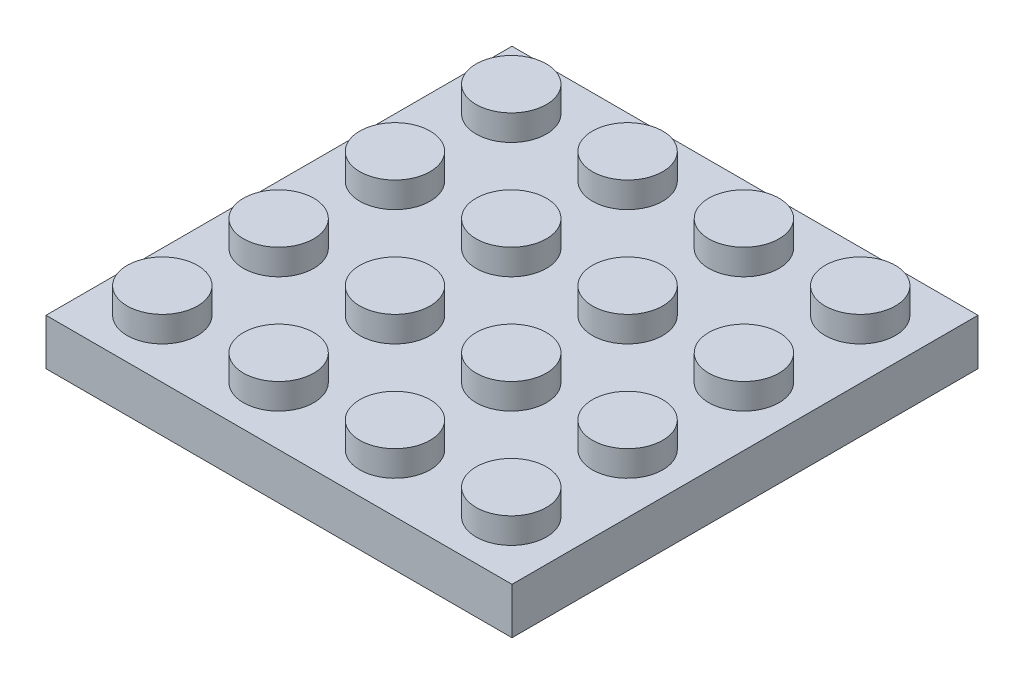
SolidWorks part; units mm, degrees
ref_plane "Front Plane" through (0, 0, 0) normal (0, 0, 1) x (1, 0, 0)
ref_plane "Top Plane" through (0, 0, 0) normal (0, 1, 0) x (1, 0, 0)
ref_plane "Right Plane" through (0, 0, 0) normal (1, 0, 0) x (0, 0, -1)
sketch "Sketch1" plane through (0, 0, 0) normal (0, 1, 0) x (1, 0, 0)
  line L0 (-15.9, 15.9) -> (15.9, -15.9) construction
  line L1 (-15.9, 15.9) -> (15.9, 15.9)
  line L2 (-15.9, 15.9) -> (-15.9, -15.9)
  line L3 (-15.9, -15.9) -> (15.9, -15.9)
  line L4 (15.9, 15.9) -> (15.9, -15.9)
  dimension "D1" = 31.8
  dimension "D2" = 31.8
extrude "Extrude1" add sketch "Sketch1" along normal blind 3.16
sketch "Sketch2" plane through (0, 3.16, 0) normal (0, 1, 0) x (1, 0, 0)
  line L0 (-15.9, -15.9) -> (15.9, -15.9) construction
  line L1 (-15.9, 15.9) -> (-15.9, -15.9) construction
  line L2 (-11.9313, -11.9313) -> (-3.9937, -11.9313) construction
  line L3 (-11.9313, -11.9313) -> (-11.9313, -3.9938) construction
  circle A0 centre (-11.9313, -11.9313) radius 2.4
  circle A4 centre (-3.9937, -11.9313) radius 2.4
  circle A5 centre (3.9437, -11.9313) radius 2.4
  circle A6 centre (11.8812, -11.9313) radius 2.4
  circle A7 centre (-11.9313, -3.9938) radius 2.4
  circle A8 centre (-3.9937, -3.9938) radius 2.4
  circle A14 centre (3.9438, -3.9938) radius 2.4
  circle A15 centre (11.8813, -3.9938) radius 2.4
  circle A16 centre (-11.9313, 3.9437) radius 2.4
  circle A17 centre (-3.9938, 3.9437) radius 2.4
  circle A18 centre (3.9437, 3.9437) radius 2.4
  circle A19 centre (11.8812, 3.9437) radius 2.4
  circle A20 centre (-11.9313, 11.8812) radius 2.4
  circle A21 centre (-3.9938, 11.8812) radius 2.4
  circle A22 centre (3.9437, 11.8812) radius 2.4
  circle A23 centre (11.8812, 11.8812) radius 2.4
  dimension "D3" = 4.8
  dimension "D1" = 3.9688
  dimension "D2" = 3.9688
  dimension "D4" = 7.9375
  dimension "D5" = 7.9375
  dimension "D6" = 90
extrude "Extrude2" add sketch "Sketch2" along normal blind 1.75
shell "Shell1" thickness 1.5875
sketch "Sketch3" plane through (0, 1.5725, 0) normal (0, -1, 0) x (1, 0, 0)
  line L0 (-15.9, 15.9) -> (15.9, 15.9) construction
  line L2 (-15.9, -15.9) -> (-15.9, 15.9) construction
  line L3 (-7.9625, 7.9625) -> (-0.025, 7.9625) construction
  line L4 (-7.9625, 7.9625) -> (-7.9625, 0.025) construction
  circle A0 centre (-7.9625, 7.9625) radius 3.175
  circle A1 centre (-7.9625, 7.9625) radius 2.3813
  circle A2 centre (-0.025, 7.9625) radius 2.3813
  circle A3 centre (-0.025, 7.9625) radius 3.175
  circle A4 centre (7.9125, 7.9625) radius 2.3813
  circle A5 centre (7.9125, 7.9625) radius 3.175
  circle A12 centre (-7.9625, 0.025) radius 2.3813
  circle A13 centre (-7.9625, 0.025) radius 3.175
  circle A14 centre (-0.025, 0.025) radius 2.3813
  circle A15 centre (-0.025, 0.025) radius 3.175
  circle A16 centre (7.9125, 0.025) radius 2.3813
  circle A17 centre (7.9125, 0.025) radius 3.175
  circle A18 centre (-7.9625, -7.9125) radius 2.3813
  circle A19 centre (-7.9625, -7.9125) radius 3.175
  circle A20 centre (-0.025, -7.9125) radius 2.3813
  circle A21 centre (-0.025, -7.9125) radius 3.175
  circle A22 centre (7.9125, -7.9125) radius 2.3813
  circle A23 centre (7.9125, -7.9125) radius 3.175
  dimension "D1" = 6.35
  dimension "D2" = 4.7625
  dimension "D6" = 90
  dimension "D3" = 7.9375
  dimension "D4" = 7.9375
  dimension "D5" = 7.9375
  dimension "D7" = 7.9375
extrude "Extrude3" add sketch "Sketch3" along normal through all
